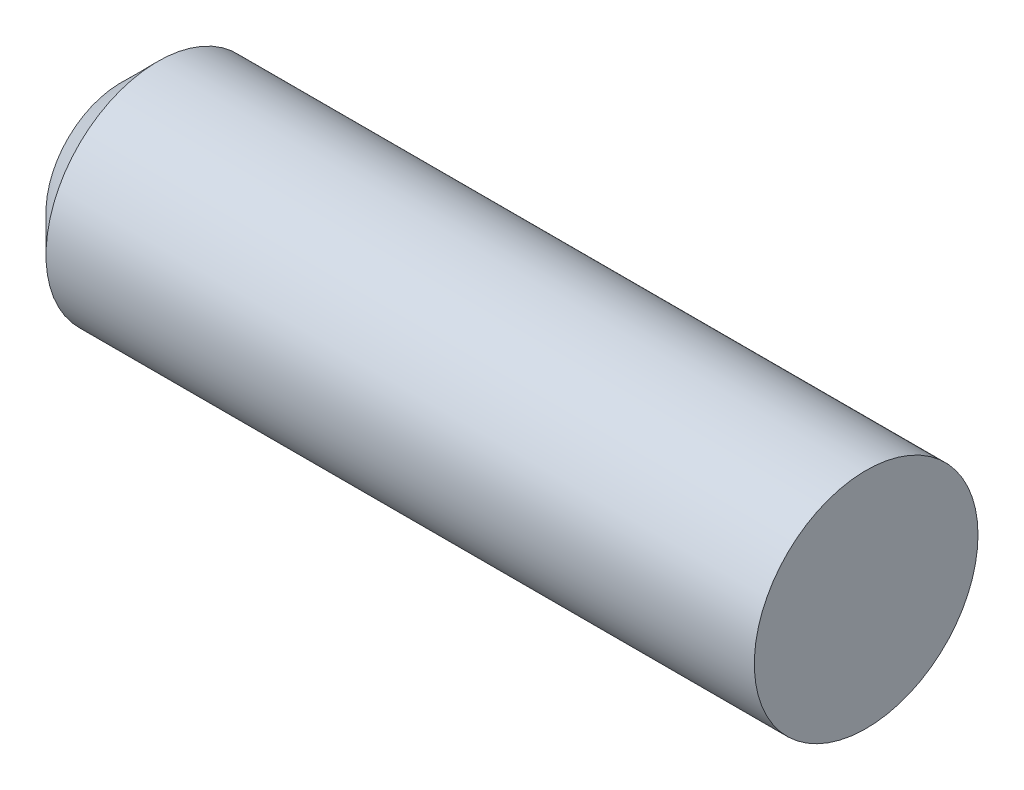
SolidWorks part; units mm, degrees
ref_plane "Front Plane" through (0, 0, 0) normal (1, 0, 0) x (0, 1, 0)
ref_plane "Top Plane" through (0, 0, 0) normal (0, 0, 1) x (0, 1, 0)
ref_plane "Right Plane" through (0, 0, 0) normal (0, 1, 0) x (-1, 0, 0)
sketch "Sketch1" plane through (0, 0, 0) normal (1, 0, 0) x (0, 1, 0)
  circle A0 centre (0, 0) radius 1.5
  dimension "D1" = 3
extrude "Boss-Extrude1" add sketch "Sketch1" along normal blind 10
chamfer "Chamfer1" distance 0.5 angle 45 1 edges at (0, 0, -1.5)
